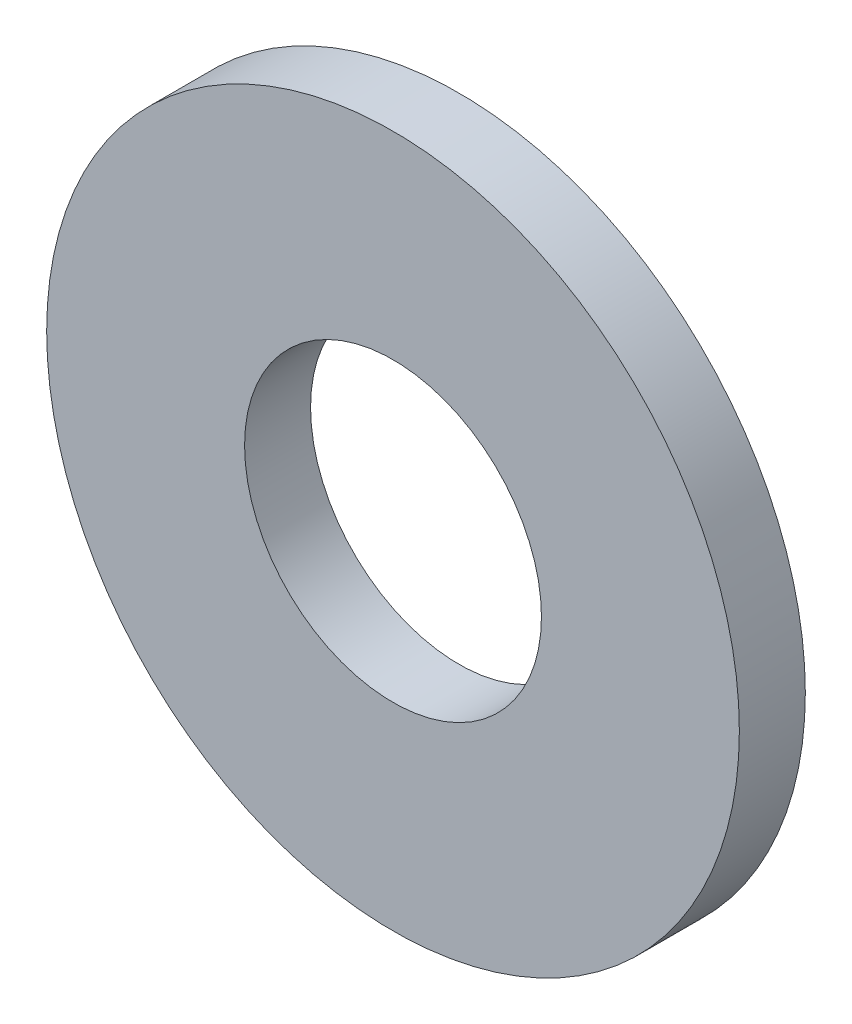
SolidWorks part; units mm, degrees
ref_plane "Plan1" through (0, 0, 0) normal (0, 0, 1) x (1, 0, 0)
ref_plane "Plan2" through (0, 0, 0) normal (0, 1, 0) x (1, 0, 0)
ref_plane "Plan3" through (0, 0, 0) normal (1, 0, 0) x (0, 0, -1)
sketch "Esquisse1" plane through (0, 0, 0) normal (0, 0, 1) x (1, 0, 0)
  circle A0 centre (0, 0) radius 31.5
  circle A1 centre (0, 0) radius 13.5
  dimension "D1" = 27
  dimension "D2" = 63
extrude "Base-Extrusion" add sketch "Esquisse1" against normal blind 6
